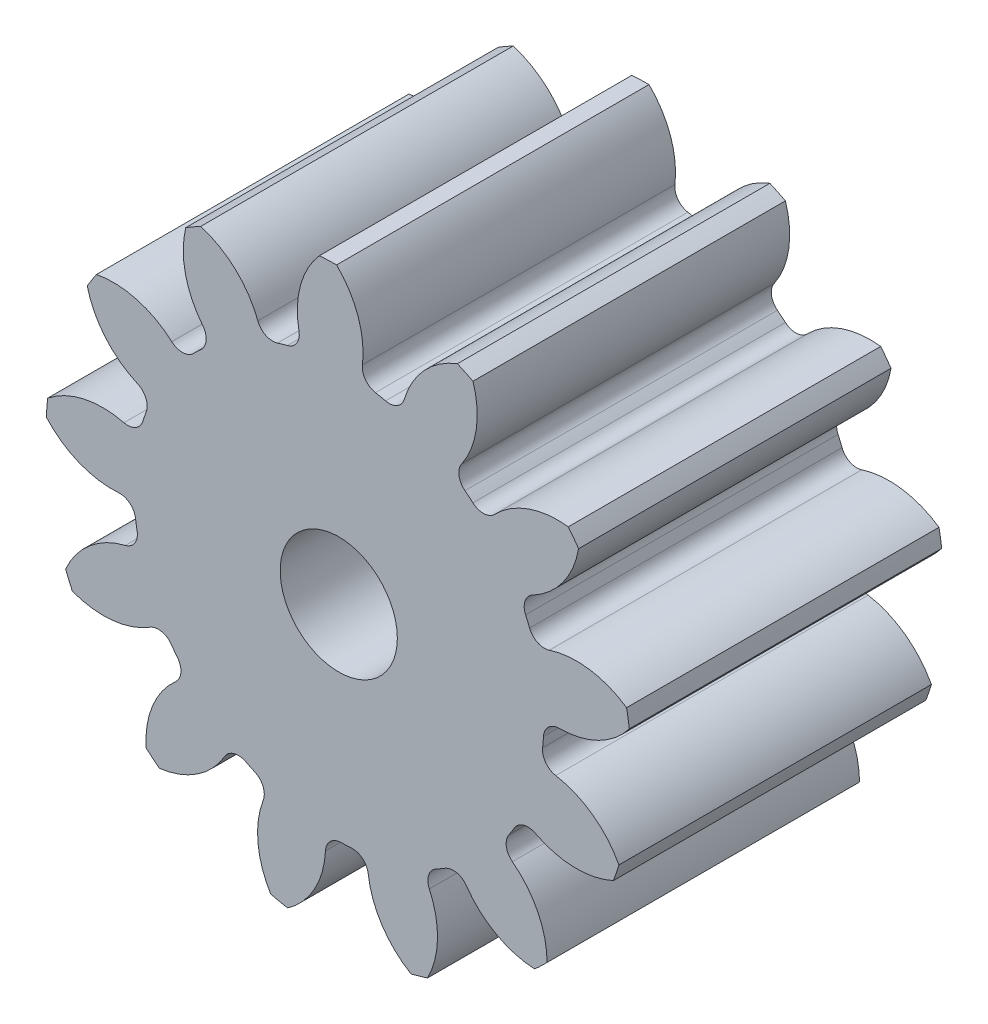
SolidWorks part; units mm, degrees
ref_plane "Front" through (0, 0, 0) normal (0, 0, 1) x (1, 0, 0)
ref_plane "Top" through (0, 0, 0) normal (0, 1, 0) x (1, 0, 0)
ref_plane "Right" through (0, 0, 0) normal (1, 0, 0) x (0, 0, -1)
sketch "Sketch3" plane through (0, 0, 0) normal (0, 0, 1) x (1, 0, 0)
  circle A0 centre (0, 0) radius 95.25
  dimension "od" = 190.5
extrude "gearBody" add sketch "Sketch3" along normal blind 101.6
sketch "Sketch2" plane through (0, 0, 0) normal (0, 0, 1) x (1, 0, 0)
  line L0 (0, 0) -> (71.6668, 29.6854) construction
  line L1 (91.6931, -28.9923) -> (0, 0) construction
  line L2 (0, 0) -> (36.3143, 0) construction
  line L3 (82.4933, 3.0583) -> (80.8206, -16.8089) construction
  line L5 (81.6569, -6.8753) -> (0, 0) construction
  line L7 (0, 0) -> (77.5716, 0) construction
  arc A0 (77.5561, 1.5512) -> (76.2049, -14.4975) centre (0, 0) ccw construction
  arc A1 (94.4677, 12.1829) -> (91.1006, -27.8072) centre (0, 0) ccw construction
  arc A2 (82.4933, 3.0583) -> (80.8206, -16.8089) centre (0, 0) ccw construction
  arc A3 (66.2784, -7.2613) -> (66.5595, -3.9233) centre (0, 0) ccw
  arc A4 (91.6931, -28.9923) -> (70.5444, -12.919) centre (65.6942, -41.2508) ccw
  arc A5 (91.6931, -28.9923) -> (95.25, 13.2522) centre (0, 0) ccw
  arc A6 (95.25, 13.2522) -> (71.7114, 0.9415) centre (71.6668, 29.6854) cw
  arc A7 (66.5595, -3.9233) -> (71.7114, 0.9415) centre (71.7194, -4.2274) cw
  arc A8 (70.5444, -12.919) -> (66.2784, -7.2613) centre (71.4166, -7.8242) cw
  point P6 (95.25, 13.2522)
  point P22 (91.6931, -28.9923)
  dimension "baseDia" = 155.1433
  dimension "od" = 190.5
  dimension "pd" = 165.1
  dimension "rd" = 133.35
  dimension "rFillet" = 5.1689
  dimension "pointX" = 95.25
  dimension "pointY" = 13.2522
  dimension "CTT" = 19.8672
  dimension "flankCenterAngle" = 22.5
extrude "toothCut" cut sketch "Sketch2" along normal through all
pattern_circular "CirPattern1" count 13 over 360 about axis through (0, 0, 0) along (0, 0, 1) of "toothCut"
sketch "hub1Dia" plane through (0, 0, 0) normal (0, 0, -1) x (-1, 0, 0)
  circle A0 centre (0, 0) radius 12.7
  dimension "hub1Dia" = 25.4
sketch "hub2Dia" plane through (0, 0, 101.6) normal (0, 0, 1) x (1, 0, 0)
  circle A0 centre (0, 0) radius 12.7
  dimension "hub2dia" = 25.4
sketch "boreDia" plane through (0, 0, 0) normal (0, 0, 1) x (1, 0, 0)
  circle A0 centre (0, 0) radius 19.05
  dimension "boreDia" = 38.1
extrude "bore" cut sketch "boreDia" against normal mid plane 25400
